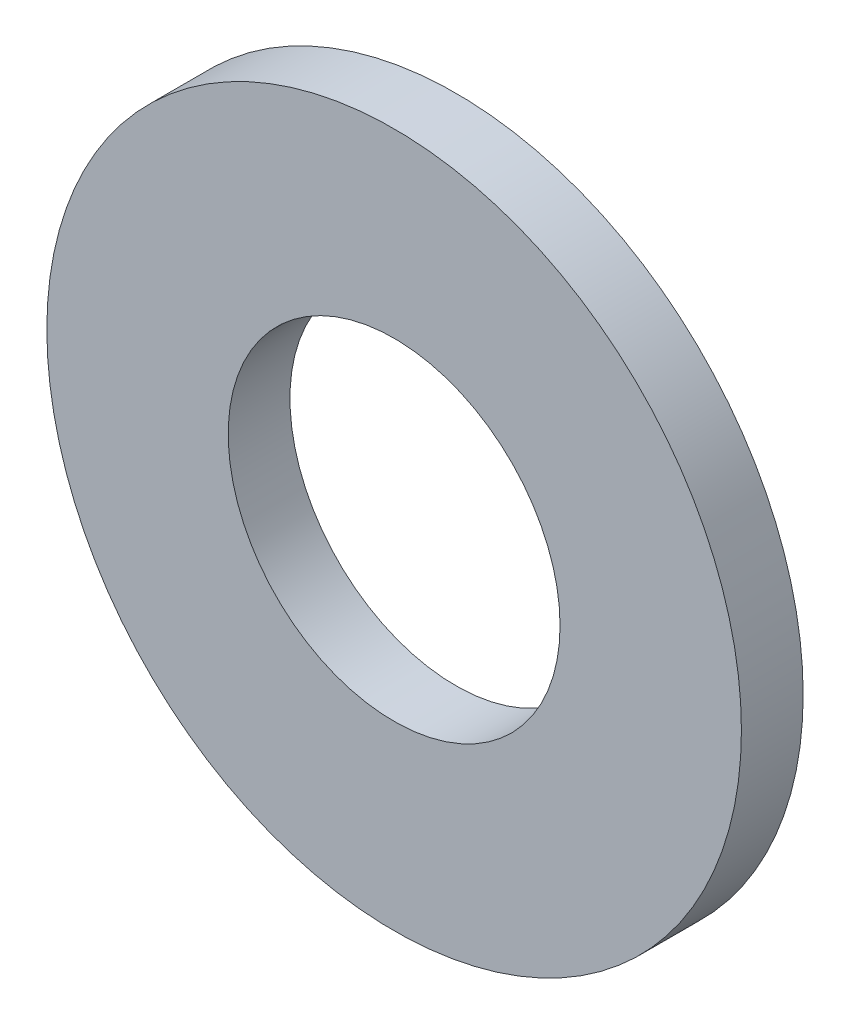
SolidWorks part; units mm, degrees
ref_plane "前视基准面" through (0, 0, 0) normal (0, 0, 1) x (1, 0, 0)
ref_plane "上视基准面" through (0, 0, 0) normal (0, 1, 0) x (1, 0, 0)
ref_plane "右视基准面" through (0, 0, 0) normal (1, 0, 0) x (0, 0, -1)
other "Configuration Table"
sketch "草图1" plane through (0, 0, 0) normal (0, 0, 1) x (1, 0, 0)
  circle A0 centre (0, 0) radius 4.5
  circle A1 centre (0, 0) radius 2.15
  dimension "D1" = 4.3
  dimension "D2" = 9
extrude "Washer_envelope" add sketch "草图1" along normal blind 0.8
